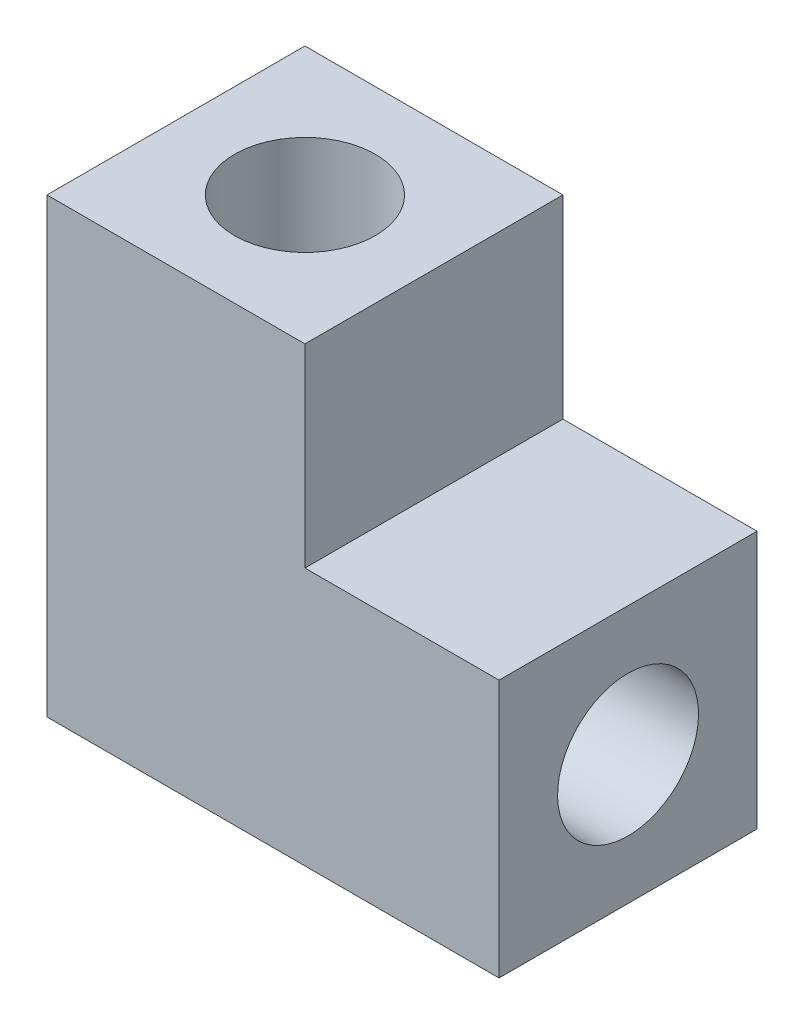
SolidWorks part; units mm, degrees
ref_plane "Front Plane" through (0, 0, 0) normal (0, 0, 1) x (1, 0, 0)
ref_plane "Top Plane" through (0, 0, 0) normal (0, 1, 0) x (1, 0, 0)
ref_plane "Right Plane" through (0, 0, 0) normal (1, 0, 0) x (0, 0, -1)
sketch "Sketch1" plane through (0, 0, 0) normal (0, 0, 1) x (1, 0, 0)
  line L1 (0, 0) -> (17, 0)
  line L2 (0, 0) -> (0, 17)
  line L3 (0, 17) -> (17, 17)
  line L4 (17, 0) -> (17, 17)
  dimension "D1" = 17
  dimension "D2" = 17
extrude "Extrude1" add sketch "Sketch1" along normal blind 9.7
sketch "Sketch2" plane through (0, 0, 9.7) normal (0, 0, 1) x (1, 0, 0)
  line L1 (9.7, 17) -> (17, 17)
  line L2 (9.7, 17) -> (9.7, 9.7)
  line L3 (9.7, 9.7) -> (17, 9.7)
  line L4 (17, 17) -> (17, 9.7)
  line L5 (17, 0) -> (17, 17) construction
  line L6 (0, 17) -> (0, 0) construction
  line L7 (17, 17) -> (0, 17) construction
  line L8 (0, 0) -> (17, 0) construction
  dimension "D1" = 9.7
  dimension "D2" = 9.7
extrude "Cut-Extrude1" cut sketch "Sketch2" against normal up to next
sketch "Sketch3" plane through (0, 17, 0) normal (0, 1, 0) x (-1, 0, 0)
  circle A0 centre (-4.85, 4.85) radius 2.65
extrude "Cut-Extrude2" cut sketch "Sketch3" against normal blind 8.79
sketch "Sketch5" plane through (17, 0, 0) normal (1, 0, 0) x (0, 0, -1)
  circle A0 centre (-4.85, 4.85) radius 2.65
extrude "Cut-Extrude3" cut sketch "Sketch5" against normal blind 8.79
